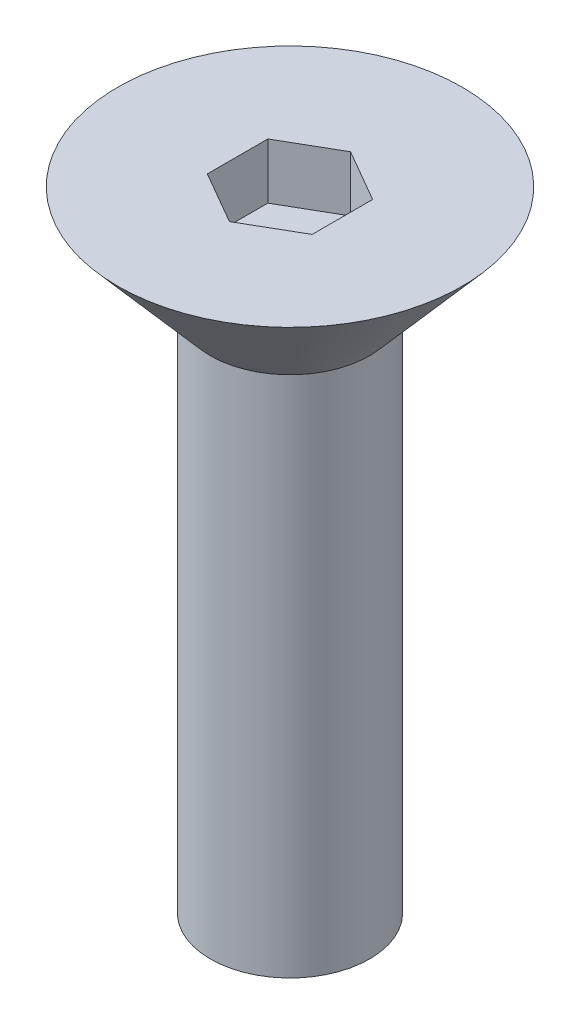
SolidWorks part; units mm, degrees
ref_plane "Plane1" through (0, 0, 0) normal (0, 0, 1) x (1, 0, 0)
ref_plane "Plane2" through (0, 0, 0) normal (0, 1, 0) x (1, 0, 0)
ref_plane "Plane3" through (0, 0, 0) normal (1, 0, 0) x (0, 0, -1)
sketch "Sketch1" plane through (0, 0, 0) normal (0, 0, 1) x (1, 0, 0)
  line L0 (0, 0) -> (5.2197, 0)
  line L1 (2.413, -3.2287) -> (5.2197, 0)
  line L4 (2.413, -3.2287) -> (2.413, -19.0529)
  line L5 (0, 25.4) -> (0, -50.8) construction
  line L6 (2.413, -19.0529) -> (0, -19.0529)
  line L7 (0, 0) -> (0, -19.0529)
  dimension "HeadAngle" = 41
  dimension "HeadWidth" = 10.4394
  dimension "NominalDia" = 4.826
  dimension "ShankLength" = 15.8242
  dimension "Total Length (L)" = 19.0529
  dimension "Head Height (H)" = 3.2287
revolve "Screw" add sketch "Sketch1" angle 360 about L5
sketch "Sketch2" plane through (0, 0, 0) normal (0, 1, 0) x (-1, 0, 0)
  line L0 (0, -5.08) -> (0, 5.08) construction
  line L1 (21.2725, 0) -> (-24.4475, 0) construction
  line L2 (-1.5875, -0.9165) -> (-1.5875, 0.9165)
  line L3 (0, 1.8331) -> (-1.5875, 0.9165)
  line L4 (0, 1.8331) -> (1.5875, 0.9165)
  line L5 (1.5875, -0.9165) -> (1.5875, 0.9165)
  line L6 (0, -1.8331) -> (-1.5875, -0.9165)
  line L7 (0, -1.8331) -> (1.5875, -0.9165)
  point P8 (-1.5875, 0)
  dimension "D1" = 120
  dimension "HexWidth" = 3.175
extrude "HexCut" cut sketch "Sketch2" against normal blind 1.684
equation "\"HexDepth@HexCut\" =  ( \"HeadWidth@Sketch1\" - \"NominalDia@Sketch1\" )  *  .3"
